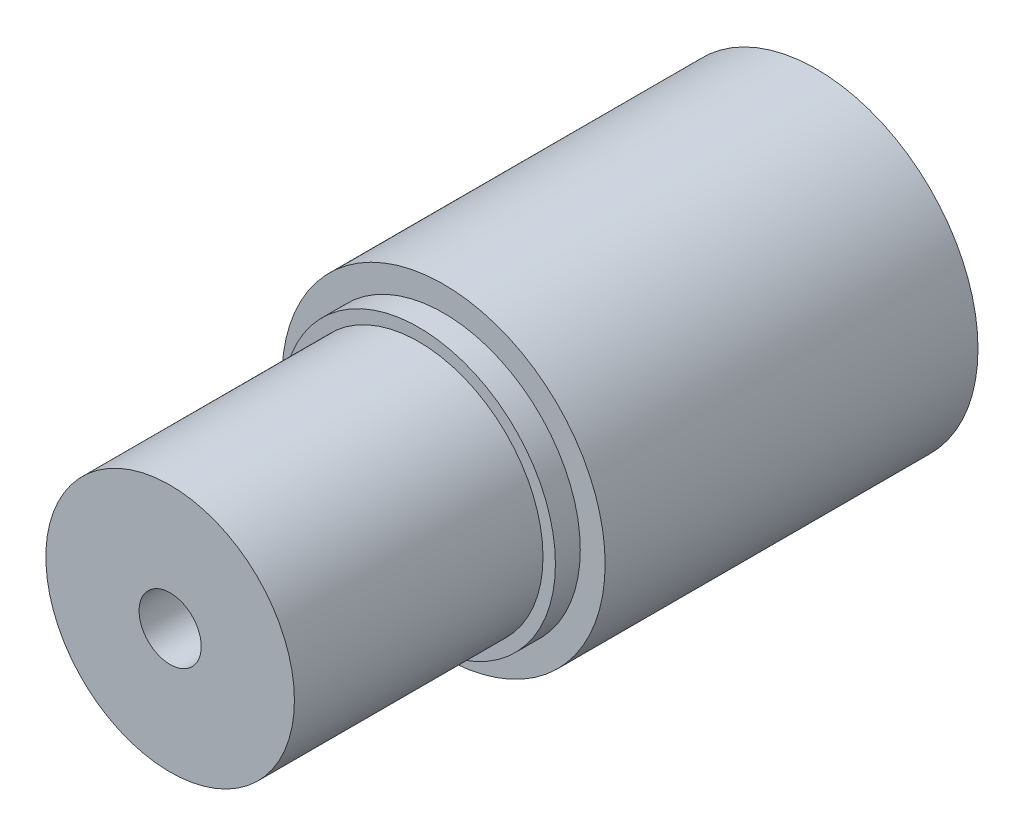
SolidWorks part; units mm, degrees
ref_plane "Plan de face" through (0, 0, 0) normal (0, 0, 1) x (1, 0, 0)
ref_plane "Plan de dessus" through (0, 0, 0) normal (0, 1, 0) x (1, 0, 0)
ref_plane "Plan de droite" through (0, 0, 0) normal (1, 0, 0) x (0, 0, -1)
sketch "Esquisse1" plane through (0, 0, 0) normal (0, 0, 1) x (1, 0, 0)
  circle A0 centre (0, 0) radius 13
  dimension "D1" = 26
extrude "Extrusion1" add sketch "Esquisse1" along normal blind 30
sketch "Esquisse3" plane through (0, 0, 0) normal (1, 0, 0) x (0, 0, -1)
  line L0 (0, 13) -> (-30, 13) construction
  line L1 (-30, 13) -> (-30, -13) construction
  line L2 (-30, 11) -> (-32, 11)
  line L3 (-32, 11) -> (-32, 10)
  line L4 (-32, 10) -> (-52, 10)
  line L5 (-52, 10) -> (-52, 0)
  line L6 (-52, 0) -> (-30, 0)
  line L7 (-30, 0) -> (-30, 11)
  dimension "D1" = 2
  dimension "D2" = 1
  dimension "D3" = 2
  dimension "D4" = 10
  dimension "D5" = 20
revolve "Révolution1" add sketch "Esquisse3" angle 360 about L6
hole_wizard "Diamètre du perçage Ø14.5 (14.5)1" positions "Esquisse5" profile "Esquisse4" hole size "Ø14.5" standard "Ansi Métrique"
sketch "Esquisse5" plane through (0, 0, 0) normal (0, 0, -1) x (-1, 0, 0)
  point P0 (0, 0)
sketch "Esquisse4" plane through (0, 0, 0) normal (1, 0, 0) x (0, 1, 0)
  line L0 (0, 0) -> (0, 16.3562)
  line L1 (0, 16.3562) -> (7.25, 12)
  line L2 (7.25, 12) -> (7.25, 0)
  line L5 (7.25, 0) -> (0, 0)
  line L10 (0, 16.3562) -> (-7.25, 12) construction
  line L11 (0, -6.35) -> (0, 107.95) construction
  dimension "Diamètre du perçage" = 14.5
  dimension "Profondeur du perçage" = 12
  dimension "Angle de pointe" = 118
hole_wizard "Trou taraudé M61" positions "Esquisse7" profile "Esquisse6" tap size "M6" standard "ISO"
sketch "Esquisse7" plane through (0, 0, 52) normal (0, 0, 1) x (1, 0, 0)
  point P0 (0, 0)
sketch "Esquisse6" plane through (0, 0, 52) normal (1, 0, 0) x (0, -1, 0)
  line L0 (0, 0) -> (0, 52)
  line L1 (0, 52) -> (2.5, 52)
  line L2 (2.5, 52) -> (2.5, 0)
  line L5 (2.5, 0) -> (0, 0)
  line L11 (0, -6.35) -> (0, 107.95) construction
  dimension "Diamètre du trou pour taraudage jusqu'au prochain" = 5
  dimension "Profondeur du trou pour taraudage jusqu'au prochain" = 52
